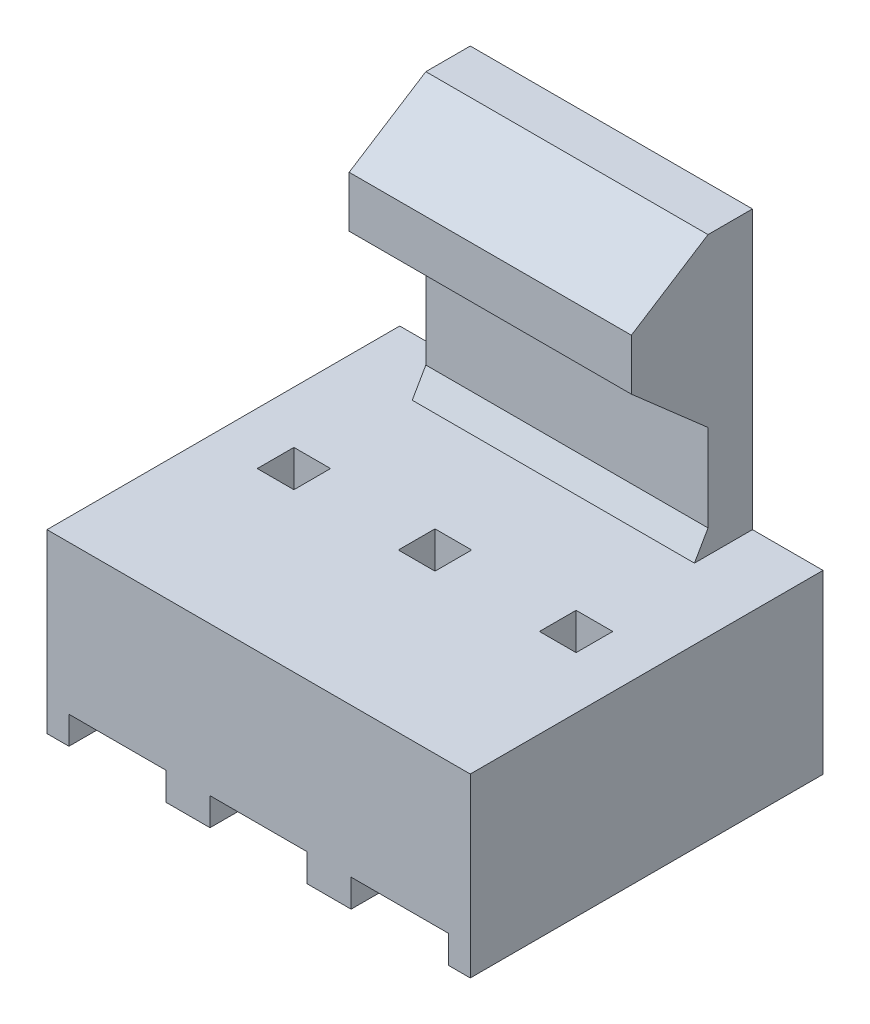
SolidWorks part; units mm, degrees
ref_plane "Front Plane" through (0, 0, 0) normal (0, 0, 1) x (1, 0, 0)
ref_plane "Top Plane" through (0, 0, 0) normal (0, 1, 0) x (1, 0, 0)
ref_plane "Right Plane" through (0, 0, 0) normal (1, 0, 0) x (0, 0, -1)
sketch "Sketch1" plane through (0, 0, 0) normal (0, 1, 0) x (1, 0, 0)
  line L1 (-3.81, 0) -> (3.81, 0)
  line L2 (-3.81, 0) -> (-3.81, 6.35)
  line L3 (-3.81, 6.35) -> (3.81, 6.35)
  line L4 (3.81, 0) -> (3.81, 6.35)
  dimension "D1" = 7.62
  dimension "D2" = 6.35
extrude "Extrude1" add sketch "Sketch1" against normal blind 3.18
sketch "Sketch2" plane through (0, 0, 0) normal (0, 0, 1) x (1, 0, 0)
  line L0 (-3.81, -3.18) -> (3.81, -3.18) construction
  line L1 (-3.415, -3.18) -> (-1.665, -3.18)
  line L2 (-3.415, -3.18) -> (-3.415, -2.68)
  line L3 (-3.415, -2.68) -> (-1.665, -2.68)
  line L4 (-1.665, -3.18) -> (-1.665, -2.68)
  line L5 (-0.875, -3.18) -> (0.875, -3.18)
  line L6 (0, -3.18) -> (0, 2.4197) construction
  line L7 (-0.875, -3.18) -> (-0.875, -2.68)
  line L8 (-0.875, -2.68) -> (0.875, -2.68)
  line L9 (0.875, -3.18) -> (0.875, -2.68)
  line L10 (1.665, -3.18) -> (3.415, -3.18)
  line L11 (-2.54, -3.18) -> (-2.54, -1.3641) construction
  line L12 (-3.81, -3.18) -> (-3.81, 0) construction
  line L13 (1.665, -3.18) -> (1.665, -2.68)
  line L14 (1.665, -2.68) -> (3.415, -2.68)
  line L15 (3.415, -3.18) -> (3.415, -2.68)
  dimension "D1" = 3.81
  dimension "D2" = 1.75
  dimension "D3" = 0.5
  dimension "D4" = 1.27
extrude "Cut-Extrude1" cut sketch "Sketch2" against normal up to next
sketch "Sketch3" plane through (0, 0, 0) normal (0, 1, 0) x (-1, 0, 0)
  line L0 (3.3617, -3.175) -> (-3.4699, -3.175) construction
  line L1 (2.54, -7.0175) -> (2.54, 1.0316) construction
  line L2 (0, 0) -> (0, -7.6595) construction
  line L3 (-3.81, -6.35) -> (3.81, -6.35) construction
  line L4 (2.87, -3.505) -> (2.21, -3.505)
  line L5 (2.87, -3.505) -> (2.87, -2.845)
  line L6 (2.87, -2.845) -> (2.21, -2.845)
  line L7 (2.21, -3.505) -> (2.21, -2.845)
  line L8 (3.81, -6.35) -> (3.81, 0) construction
  line L10 (0.33, -3.505) -> (0.33, -2.845)
  line L11 (0.33, -3.505) -> (-0.33, -3.505)
  line L12 (-0.33, -3.505) -> (-0.33, -2.845)
  line L13 (0.33, -2.845) -> (-0.33, -2.845)
  line L14 (-2.21, -3.505) -> (-2.21, -2.845)
  line L15 (-2.21, -3.505) -> (-2.87, -3.505)
  line L16 (-2.87, -3.505) -> (-2.87, -2.845)
  line L17 (-2.21, -2.845) -> (-2.87, -2.845)
  dimension "D1" = 3.175
  dimension "D2" = 1.27
  dimension "D4" = 0.66
  dimension "D5" = 0.66
  dimension "D6" = 0.33
  dimension "D7" = 0.33
extrude "Cut-Extrude2" cut sketch "Sketch3" against normal up to next
sketch "Sketch5" plane through (0, 0, 0) normal (1, 0, 0) x (0, 0, -1)
  line L0 (6.35, -3.18) -> (6.35, 0) construction
  line L1 (6.35, 0) -> (6.35, 5)
  line L2 (6.35, 5) -> (5.55, 5)
  line L3 (4.17, 3.2019) -> (4.17, 4.1214)
  line L4 (5.55, 1.9929) -> (5.55, 0.4263)
  line L5 (0, 0) -> (6.35, 0) construction
  line L6 (5.55, 1.9929) -> (4.17, 3.2019)
  line L7 (5.3054, 0) -> (6.35, 0)
  line L8 (4.17, 4.1214) -> (5.55, 5)
  line L9 (0, -3.18) -> (6.35, -3.18) construction
  line L10 (0, -3.18) -> (6.35, -3.18) construction
  line L11 (3.1, -3.18) -> (3.1, 5.9256) construction
  line L12 (5.55, 0.4263) -> (5.3054, 0)
  dimension "D1" = 8.18
  dimension "D2" = 3.25
  dimension "D3" = 1.07
  dimension "D4" = 0.8
extrude "Extrude2" add sketch "Sketch5" along normal mid plane 5.08
equation "\"D5@Sketch3\" = \"D4@Sketch3\""
equation "\"D6@Sketch3\" = \"D4@Sketch3\"/2"
equation "\"D7@Sketch3\" = \"D6@Sketch3\""
equation "\"D1@Sketch3\" = \"D2@Sketch1\"/2"
